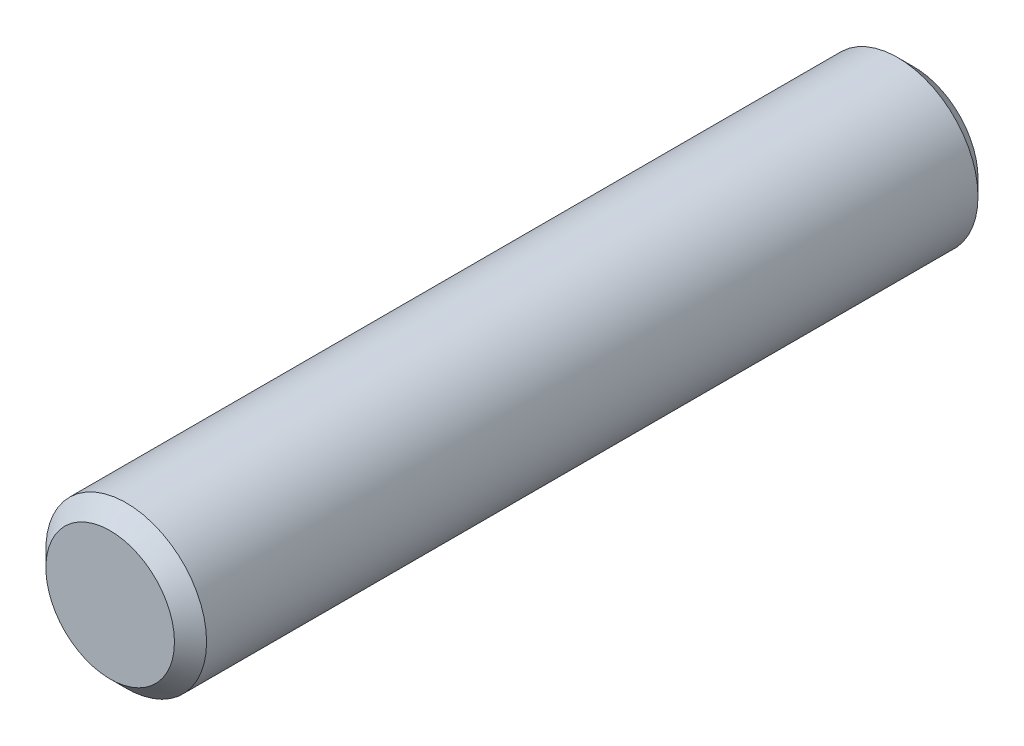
SolidWorks part; units mm, degrees
ref_plane "Face" through (0, 0, 0) normal (0, 0, 1) x (1, 0, 0)
ref_plane "Dessus" through (0, 0, 0) normal (0, 1, 0) x (1, 0, 0)
ref_plane "Droite" through (0, 0, 0) normal (1, 0, 0) x (0, 0, -1)
sketch "Esquisse1" plane through (0, 0, 0) normal (0, 0, 1) x (1, 0, 0)
  circle A0 centre (0, 0) radius 10
  dimension "D1" = 20
extrude "Base-Extrusion" add sketch "Esquisse1" along normal blind 100
chamfer "Chanfrein1" distance 2 angle 45
